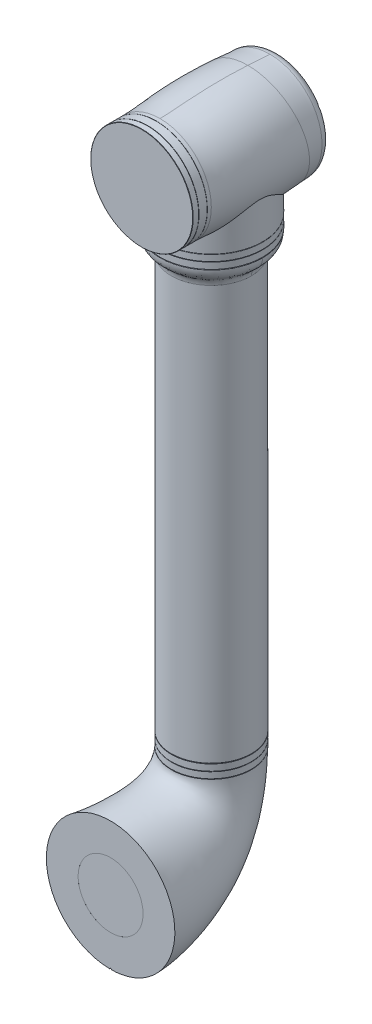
SolidWorks part; units mm, degrees
ref_plane "前视基准面" through (0, 0, 0) normal (0, 0, 1) x (1, 0, 0)
ref_plane "上视基准面" through (0, 0, 0) normal (0, 1, 0) x (1, 0, 0)
ref_plane "右视基准面" through (0, 0, 0) normal (1, 0, 0) x (0, 0, -1)
imported_body "输入1"
imported_body "输入2"
imported_body "输入3"
imported_body "输入4"
imported_body "输入5"
sketch "草图1" plane through (0, 0, -335.16) normal (0, 0, 1) x (1, 0, 0)
  circle A0 centre (0, 1015.5) radius 37.3724
extrude "切除-拉伸1" cut sketch "草图1" against normal blind 0.01
other "移动面1" parameters "D1"=0.01
sketch "草图2" plane through (0, 0, -335.15) normal (0, 0, 1) x (1, 0, 0)
  circle A0 centre (0, 941.5) radius 1
  spline S0 degree 3 poles (0, 941.5) (3.5413, 941.5) (10.4868, 942.0064) (20.4695, 944.1472) (29.9772, 947.5932) (38.9572, 952.31) (47.3385, 958.3052) (55.0274, 965.6292) (61.8893, 974.3984) (65.7819, 981.3486) (69.7517, 990.1843) (73.2436, 1000.9548) (74.665, 1018.6431) (71.678, 1036.8179) (64.052, 1054.1665) (52.0544, 1069.2672) (36.4958, 1080.8325) (18.6236, 1087.9572) (6.1453, 1089.5) (-6.1453, 1089.5) (-18.6236, 1087.9572) (-36.4958, 1080.8325) (-52.0544, 1069.2672) (-64.052, 1054.1665) (-71.678, 1036.8179) (-74.665, 1018.6431) (-73.2436, 1000.9548) (-69.7517, 990.1843) (-65.7819, 981.3486) (-61.8893, 974.3984) (-55.0274, 965.6292) (-47.3385, 958.3052) (-38.9572, 952.31) (-29.9772, 947.5932) (-20.4695, 944.1472) (-10.4868, 942.0064) (-3.5413, 941.5) (0, 941.5) (3.5413, 941.5) (10.4868, 942.0064) knots -0.02705 0 0 0 0.02705 0.054099 0.081149 0.108199 0.135248 0.162298 0.189347 0.216397 0.216397 0.251847 0.287298 0.322748 0.358199 0.393649 0.429099 0.46455 0.5 0.5 0.53545 0.570901 0.606351 0.641801 0.677252 0.712702 0.748153 0.783603 0.783603 0.810653 0.837702 0.864752 0.891801 0.918851 0.945901 0.97295 1 1 1 1.02705 1.054099 1.081149 only from (0, 941.5) to (0, 941.5) construction
  dimension "D1" = 2
extrude "切除-拉伸2" cut sketch "草图2" against normal blind 3
other "删除面1"
sketch "草图3" plane through (0, 1638.5, 0) normal (0, -1, 0) x (1, 0, 0)
  circle A0 centre (0, -510.15) radius 1
  dimension "D1" = 2
extrude "切除-拉伸3" cut sketch "草图3" against normal blind 3
ref_plane "基准面1" through (0, 0, -387.65) normal (0, 0, 1) x (1, 0, 0)
sketch "草图4" plane through (0, 0, -387.65) normal (0, 0, 1) x (1, 0, 0)
  circle A0 centre (0, 1643.8) radius 1
  arc A1 (-58.0901, 1694.0603) -> (58.0901, 1710.9397) centre (0, 1702.5) ccw construction
  dimension "D1" = 2
extrude "切除-拉伸4" cut sketch "草图4" against normal blind 3
